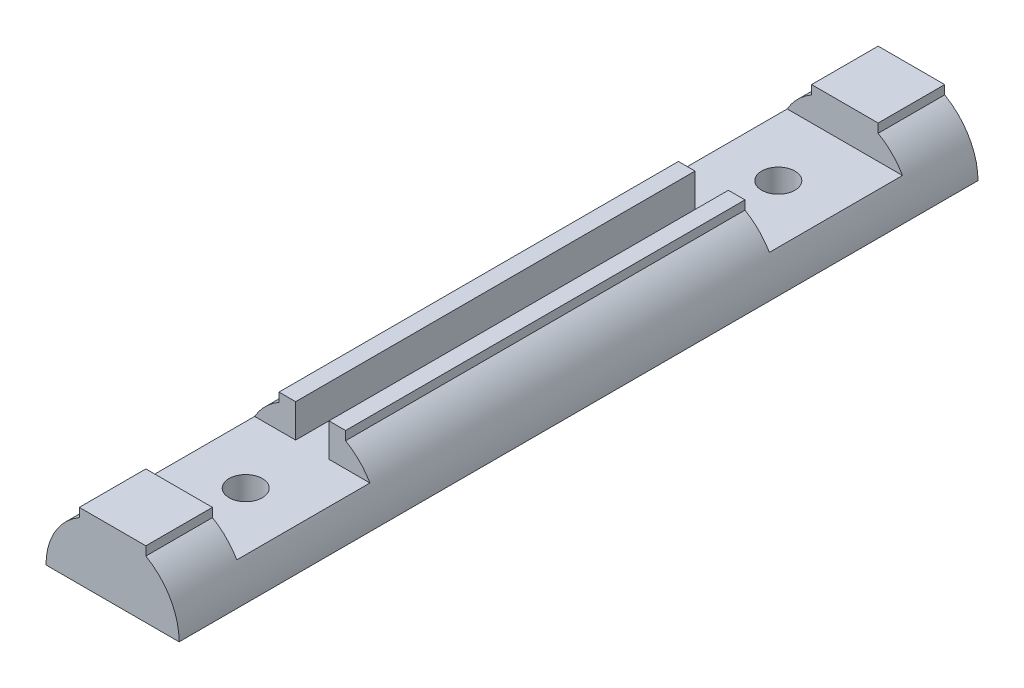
SolidWorks part; units mm, degrees
ref_plane "Front Plane" through (0, 0, 0) normal (0, 0, 1) x (1, 0, 0)
ref_plane "Top Plane" through (0, 0, 0) normal (0, 1, 0) x (1, 0, 0)
ref_plane "Right Plane" through (0, 0, 0) normal (1, 0, 0) x (0, 0, -1)
sketch "Sketch1" plane through (0, 0, 0) normal (0, 0, 1) x (1, 0, 0)
  circle A0 centre (0, 0) radius 10
  dimension "D1" = 20
extrude "Boss-Extrude1" add sketch "Sketch1" along normal mid plane 120
sketch "Sketch2" plane through (0, 0, 60) normal (0, 0, 1) x (1, 0, 0)
  line L1 (5, -10) -> (-5, -10)
  line L2 (5, -10) -> (5, 10)
  line L3 (5, 10) -> (-5, 10)
  line L4 (-5, -10) -> (-5, 10)
  line L5 (5, -10) -> (-5, 10) construction
  line L6 (5, 10) -> (-5, -10) construction
  circle A0 centre (0, 0) radius 10 construction
  point P0 (0, 0)
  dimension "D2" = 10
extrude "Boss-Extrude2" add sketch "Sketch2" against normal up to surface (120 mm away)
ref_plane "Plane1" through (0, 0, -40) normal (0, 0, -1) x (-1, 0, 0)
sketch "Sketch3" plane through (0, 0, -40) normal (0, 0, 1) x (1, 0, 0)
  line L1 (8.6603, 5) -> (-8.6603, 5)
  line L2 (8.6603, 5) -> (8.6603, 10)
  line L3 (8.6603, 10) -> (-8.6603, 10)
  line L4 (-8.6603, 5) -> (-8.6603, 10)
  line L5 (8.6603, 5) -> (-8.6603, 10) construction
  line L6 (8.6603, 10) -> (-8.6603, 5) construction
  circle A0 centre (0, 0) radius 10 construction
  point P0 (0, 7.5)
  dimension "D1" = 5
extrude "Cut-Extrude1" cut sketch "Sketch3" against normal mid plane 20
sketch "Sketch4" plane through (0, 5, 0) normal (0, 1, 0) x (1, 0, 0)
  line L0 (-8.6603, 50) -> (8.6603, 30) construction
  circle A0 centre (0, 40) radius 2.5
  dimension "D1" = 5
extrude "Cut-Extrude3" cut sketch "Sketch4" against normal through all
mirror "Mirror1" about plane through (0, 0, 0) normal (0, 0, 1) of "Cut-Extrude3", "Cut-Extrude1"
sketch "Sketch5" plane through (0, 10, 0) normal (0, 1, 0) x (1, 0, 0)
  line L0 (-8.6603, 30) -> (8.6603, 30) construction
  line L1 (2.5, -30) -> (-2.5, -30)
  line L2 (2.5, -30) -> (2.5, 30)
  line L3 (2.5, 30) -> (-2.5, 30)
  line L4 (-2.5, -30) -> (-2.5, 30)
  line L5 (2.5, -30) -> (-2.5, 30) construction
  line L6 (2.5, 30) -> (-2.5, -30) construction
  point P0 (0, 0)
  dimension "D1" = 5
extrude "Cut-Extrude2" cut sketch "Sketch5" against normal up to surface (5 mm away)
sketch "Sketch6" plane through (0, 0, 60) normal (0, 0, 1) x (1, 0, 0)
  line L0 (-5, -10) -> (5, -10) construction
  line L1 (10, -10) -> (-10, -10)
  line L2 (10, -10) -> (10, 0)
  line L3 (10, 0) -> (-10, 0)
  line L4 (-10, -10) -> (-10, 0)
  line L5 (10, -10) -> (-10, 0) construction
  line L6 (10, 0) -> (-10, -10) construction
  arc A0 (-5, 8.6603) -> (-5, -8.6603) centre (0, 0) ccw construction
  point P0 (0, -5)
extrude "Cut-Extrude4" cut sketch "Sketch6" against normal through all
